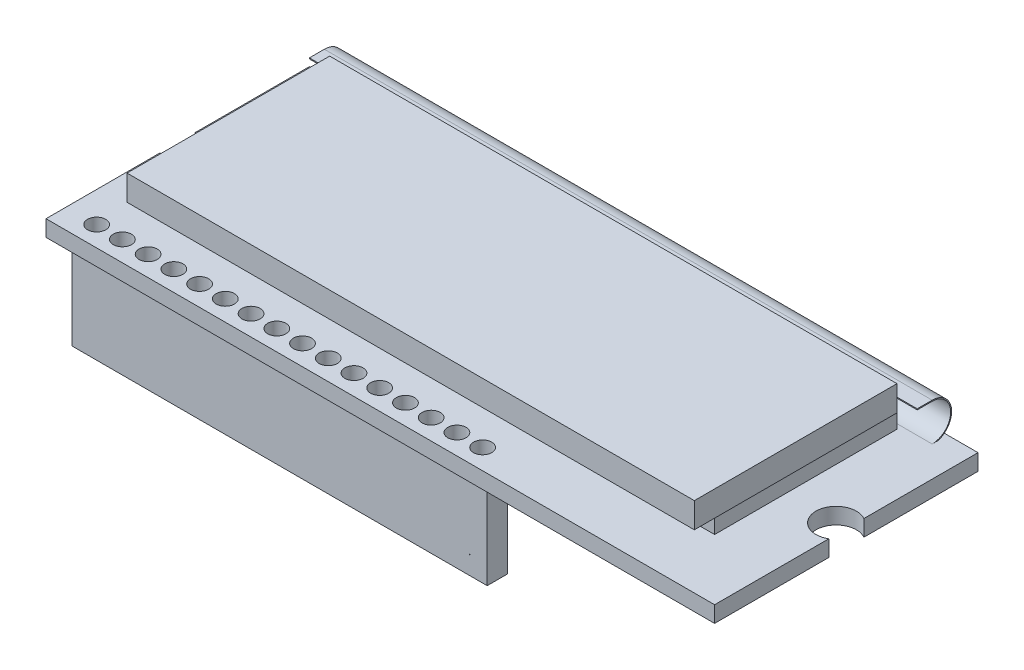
SolidWorks part; units mm, degrees
ref_plane "Front Plane" through (0, 0, 0) normal (0, 0, 1) x (1, 0, 0)
ref_plane "Top Plane" through (0, 0, 0) normal (0, 1, 0) x (1, 0, 0)
ref_plane "Right Plane" through (0, 0, 0) normal (1, 0, 0) x (0, 0, -1)
sketch "Sketch1" plane through (0, 0, 0) normal (0, 1, 0) x (1, 0, 0)
  line L1 (33, -13) -> (-33, -13)
  line L2 (33, -13) -> (33, 13)
  line L3 (33, 13) -> (-33, 13)
  line L4 (-33, -13) -> (-33, 13)
  line L5 (33, -13) -> (-33, 13) construction
  line L6 (33, 13) -> (-33, -13) construction
  point P0 (0, 0)
  dimension "D1" = 66
  dimension "D2" = 26
extrude "Boss-Extrude1" add sketch "Sketch1" along normal blind 1.6
sketch "Sketch2" plane through (0, 1.6, 0) normal (0, 1, 0) x (1, 0, 0)
  line L0 (32, 0) -> (-32, 0) construction
  line L1 (-33, 13) -> (-33, -13) construction
  circle A0 centre (-32, 0) radius 2
  circle A1 centre (32, 0) radius 2
  point P4 (0, 0)
  dimension "D1" = 1
  dimension "D2" = 4
extrude "Cut-Extrude1" cut sketch "Sketch2" against normal through all
sketch "Sketch3" plane through (0, 1.6, 0) normal (0, 1, 0) x (1, 0, 0)
  line L1 (27, -7) -> (-27, -7)
  line L2 (27, -7) -> (27, 11)
  line L3 (27, 11) -> (-27, 11)
  line L4 (-27, -7) -> (-27, 11)
  line L5 (27, -7) -> (-27, 11) construction
  line L6 (27, 11) -> (-27, -7) construction
  line L7 (33, 13) -> (-33, 13) construction
  line L8 (-33, 13) -> (-33, 1.7321) construction
  line L9 (0, 0) -> (0, 2) construction
  point P0 (0, 2)
  dimension "D1" = 54
  dimension "D2" = 18
  dimension "D4" = 2
  dimension "D5" = 6
extrude "Boss-Extrude2" add sketch "Sketch3" along normal blind 2.4
sketch "Sketch4" plane through (0, 4, 0) normal (0, 1, 0) x (1, 0, 0)
  line L1 (28, -10) -> (-28, -10)
  line L2 (28, -10) -> (28, 10)
  line L3 (28, 10) -> (-28, 10)
  line L4 (-28, -10) -> (-28, 10)
  line L5 (28, -10) -> (-28, 10) construction
  line L6 (28, 10) -> (-28, -10) construction
  point P0 (0, 0)
extrude "Boss-Extrude3" add sketch "Sketch4" along normal blind 2.5
sketch "Sketch5" plane through (0, 0, 0) normal (1, 0, 0) x (0, 0, -1)
  line L0 (10, 5.25) -> (11.475, 5.25)
  line L1 (10, 6.5) -> (10, 4) construction
  line L2 (13, 1.6) -> (11.475, 1.6) construction
  line L3 (1.7321, 1.6) -> (13, 1.6) construction
  line L6 (13, 1.6) -> (13, 0) construction
  arc A1 (11.475, 1.6) -> (11.475, 5.25) centre (11.475, 3.425) ccw
  point P15 (13.3, 3.425)
  dimension "D1" = 0.3
extrude "Extrude-Thin1" add sketch "Sketch5" along normal blind 30 and the other way blind 30 thin
sketch "Sketch6" plane through (0, 1.6, 0) normal (0, 1, 0) x (1, 0, 0)
  line L0 (-33, -1.7321) -> (-33, -13) construction
  line L1 (-33, -13) -> (33, -13) construction
  line L2 (-30, -11) -> (-27.46, -11) construction
  circle A0 centre (-30, -11) radius 0.9
  circle A1 centre (-27.46, -11) radius 0.9
  circle A2 centre (-24.92, -11) radius 0.9
  circle A3 centre (-22.38, -11) radius 0.9
  circle A4 centre (-19.84, -11) radius 0.9
  circle A5 centre (-17.3, -11) radius 0.9
  circle A6 centre (-14.76, -11) radius 0.9
  circle A7 centre (-12.22, -11) radius 0.9
  circle A8 centre (-9.68, -11) radius 0.9
  circle A9 centre (-7.14, -11) radius 0.9
  circle A10 centre (-4.6, -11) radius 0.9
  circle A11 centre (-2.06, -11) radius 0.9
  circle A12 centre (0.48, -11) radius 0.9
  circle A13 centre (3.02, -11) radius 0.9
  circle A14 centre (5.56, -11) radius 0.9
  circle A15 centre (8.1, -11) radius 0.9
  dimension "D1" = 3
  dimension "D2" = 1.8
  dimension "D3" = 2
  dimension "D5" = 2.54
  dimension "D4" = 16
extrude "Cut-Extrude2" cut sketch "Sketch6" against normal through all
sketch "Sketch7" plane through (0, 0, 0) normal (0, -1, 0) x (1, 0, 0)
  line L0 (-30, 11) -> (8.1, 11) construction
  line L2 (9.55, 10) -> (-31.45, 10)
  line L3 (9.55, 10) -> (9.55, 12)
  line L4 (9.55, 12) -> (-31.45, 12)
  line L5 (-31.45, 10) -> (-31.45, 12)
  line L6 (9.55, 10) -> (-31.45, 12) construction
  line L7 (9.55, 12) -> (-31.45, 10) construction
  point P4 (-10.95, 11)
  dimension "D1" = 41
  dimension "D2" = 2
extrude "Boss-Extrude4" add sketch "Sketch7" along normal blind 9
sketch "Sketch8" plane through (0, -9, 0) normal (0, -1, 0) x (1, 0, 0)
  circle A1 centre (-19.84, 11) radius 0.9
  circle A2 centre (-19.84, 11) radius 0.9
  circle A3 centre (-22.38, 11) radius 0.9
  circle A4 centre (-22.38, 11) radius 0.9
  circle A5 centre (-24.92, 11) radius 0.9
  circle A6 centre (-24.92, 11) radius 0.9
  circle A7 centre (-27.46, 11) radius 0.9
  circle A8 centre (-27.46, 11) radius 0.9
  circle A9 centre (-30, 11) radius 0.9
  circle A10 centre (-30, 11) radius 0.9
  circle A11 centre (0.48, 11) radius 0.9
  circle A12 centre (0.48, 11) radius 0.9
  circle A13 centre (-2.06, 11) radius 0.9
  circle A14 centre (-2.06, 11) radius 0.9
  circle A15 centre (-4.6, 11) radius 0.9
  circle A16 centre (-4.6, 11) radius 0.9
  circle A17 centre (-7.14, 11) radius 0.9
  circle A18 centre (-7.14, 11) radius 0.9
  circle A19 centre (-9.68, 11) radius 0.9
  circle A20 centre (-9.68, 11) radius 0.9
  circle A21 centre (-12.22, 11) radius 0.9
  circle A22 centre (-12.22, 11) radius 0.9
  circle A23 centre (-14.76, 11) radius 0.9
  circle A24 centre (-14.76, 11) radius 0.9
  circle A25 centre (-17.3, 11) radius 0.9
  circle A26 centre (-17.3, 11) radius 0.9
  circle A27 centre (8.1, 11) radius 0.9
  circle A28 centre (8.1, 11) radius 0.9
  circle A29 centre (5.56, 11) radius 0.9
  circle A30 centre (5.56, 11) radius 0.9
  circle A31 centre (3.02, 11) radius 0.9
  circle A32 centre (3.02, 11) radius 0.9
  dimension "D1" = 0
  dimension "D2" = 0
  dimension "D3" = 0
  dimension "D4" = 0
  dimension "D5" = 0
  dimension "D6" = 0
  dimension "D7" = 0
  dimension "D8" = 0
  dimension "D9" = 0
  dimension "D10" = 0
  dimension "D11" = 0
  dimension "D12" = 0
  dimension "D13" = 0
  dimension "D14" = 0
  dimension "D15" = 0
  dimension "D16" = 0
extrude "Cut-Extrude3" cut sketch "Sketch8" against normal blind 9
